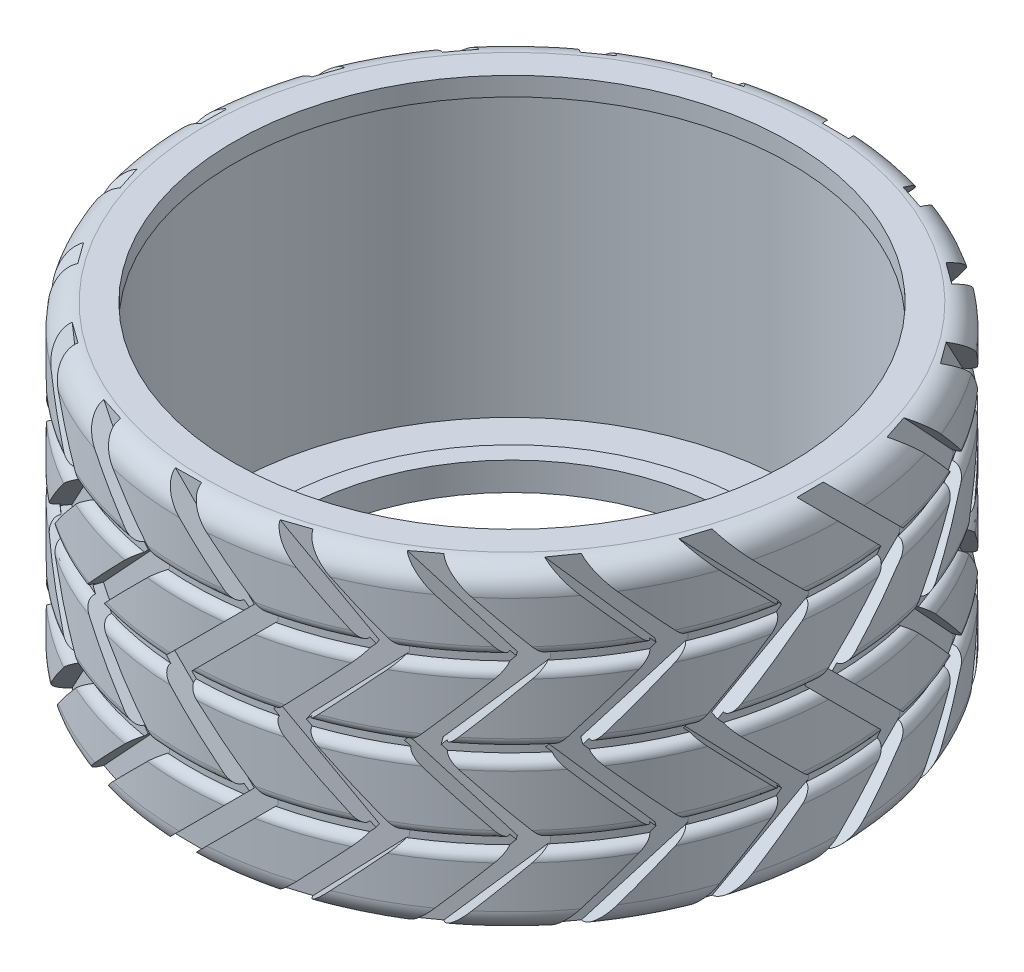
SolidWorks part; units mm, degrees
ref_plane "Front Plane" through (0, 0, 0) normal (0, 0, 1) x (1, 0, 0)
ref_plane "Top Plane" through (0, 0, 0) normal (0, 1, 0) x (1, 0, 0)
ref_plane "Right Plane" through (0, 0, 0) normal (1, 0, 0) x (0, 0, -1)
sketch "Sketch1" plane through (0, 0, 0) normal (0, 0, 1) x (1, 0, 0)
  line L0 (0, 83.6379) -> (0, -103.1897) construction
  line L1 (32.7, -17) -> (23.2, -17)
  line L2 (23.2, -17) -> (23.2, -14)
  line L3 (23.2, -14) -> (25.2, -14)
  line L4 (25.2, -14) -> (25.2, -15)
  line L5 (30.2, 15) -> (30.2, -15)
  line L6 (25.2, -15) -> (30.2, -15)
  line L7 (29.7, 15) -> (30.2, 15)
  line L10 (-63.3434, 0) -> (35.2, 0) construction
  line L12 (35.2, 14.5) -> (35.2, -14.5)
  line L13 (32.7, 17) -> (29.7, 17)
  line L14 (29.7, 15) -> (29.7, 17)
  arc A0 (35.2, -14.5) -> (32.7, -17) centre (32.7, -14.5) cw
  arc A1 (35.2, 14.5) -> (32.7, 17) centre (32.7, 14.5) ccw
  point P19 (34, -19)
  point P21 (30.2, 0)
  point P24 (34, 19)
  dimension "D8" = 2.5
  dimension "D1" = 30.2
  dimension "D2" = 2
  dimension "D3" = 2
  dimension "D4" = 15
  dimension "D5" = 3
  dimension "D6" = 5
  dimension "D7" = 5
  dimension "D9" = 3
  dimension "D10" = 2
revolve "Revolve1" add sketch "Sketch1" angle 360 about L0
sketch "Sketch2" plane through (0, 0, 0) normal (0, 0, 1) x (1, 0, 0)
  line L0 (-5.8704, 0) -> (53.8139, 0) construction
  line L1 (34.2, 9) -> (35.7422, 9)
  line L2 (34.2, 9) -> (34.2, 8)
  line L3 (34.2, 8) -> (35.7422, 8)
  line L4 (35.7422, 9) -> (35.7422, 8)
  line L5 (34.2, 0.5) -> (35.7422, 0.5)
  line L6 (34.2, 0.5) -> (34.2, -0.5)
  line L7 (34.2, -0.5) -> (35.7422, -0.5)
  line L8 (35.7422, 0.5) -> (35.7422, -0.5)
  line L9 (34.2, -8) -> (35.7422, -8)
  line L10 (34.2, -8) -> (34.2, -9)
  line L11 (34.2, -9) -> (35.7422, -9)
  line L12 (35.7422, -8) -> (35.7422, -9)
  line L13 (35.2, -14.5) -> (35.2, 14.5) construction
  line L14 (0, 29.8282) -> (0, -32.6074) construction
  line L15 (0, -32.6074) -> (-0.69, -32.6074) construction
  dimension "D1" = 1
  dimension "D2" = 1
  dimension "D3" = 9
revolve "Cut-Revolve1" cut sketch "Sketch2" angle 360 about L14
ref_plane "Plane1" through (35.2, 0, 0) normal (1, 0, 0) x (0, 0, -1)
fillet "Fillet2" radius 1 6 edges at (0, -8, -35.2) (0, -9, 35.2) (0, -0.5, 35.2) (0, 0.5, -35.2) (0, 8, 35.2) (0, 9, -35.2)
sketch "Sketch3" plane through (35.2, 0, 0) normal (1, 0, 0) x (0, 0, -1)
  line L0 (0, 0) -> (8.5, 8.5)
  line L1 (8.5, 8.5) -> (0, 17)
  line L2 (0, 0) -> (8.5, -8.5)
  line L3 (8.5, -8.5) -> (0, -17)
  line L4 (2.3901, 8.5) -> (13.9243, 8.5) construction
  line L5 (0, 18.3998) -> (0, -22.4709) construction
  line L6 (5.6716, 8.5) -> (-1.4142, 15.5858) construction
  line L7 (0, 17) -> (-2.8284, 17)
  line L8 (-0.3964, 14.568) -> (-2.8284, 17)
  line L9 (-1.4142, -15.5858) -> (-2.8284, -17)
  line L12 (5.6716, -8.5) -> (-1.4142, -15.5858)
  line L13 (-2.8284, 0) -> (5.6716, -8.5)
  line L14 (-2.8284, 0) -> (5.6716, 8.5)
  line L15 (5.6716, 8.5) -> (-0.3964, 14.568)
  line L16 (0, -17) -> (-2.8284, -17)
  line L17 (4.0358, -8.5) -> (10.0834, -8.5) construction
  line L20 (-34.2, -8) -> (34.2, -8) construction
  line L21 (-34.2, -9) -> (34.2, -9) construction
  line L22 (-34.2, 9) -> (34.2, 9) construction
  line L23 (-34.2, 8) -> (34.2, 8) construction
  dimension "D1" = 2
extrude "Cut-Extrude1" cut sketch "Sketch3" against normal blind 2
pattern_circular "CirPattern1" count 20 over 360 about axis through (0, 0, 0) along (0, 1, 0) of "Cut-Extrude1"
